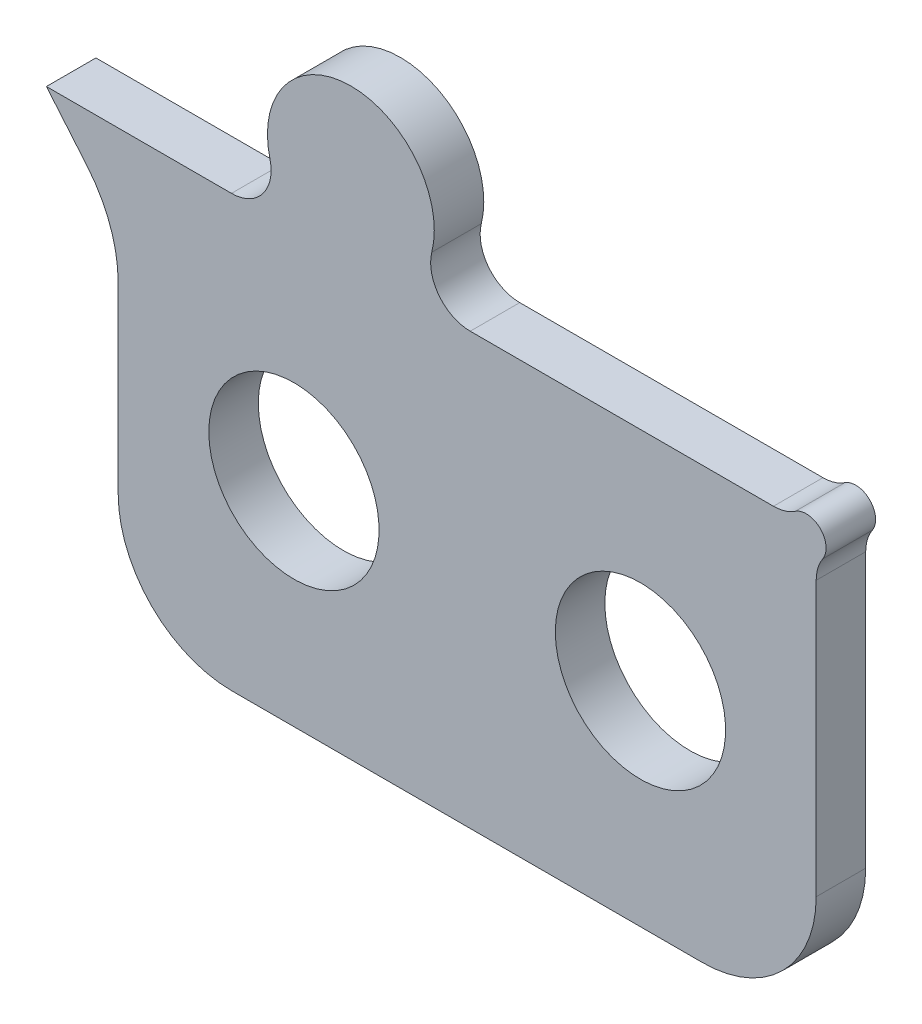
SolidWorks part; units mm, degrees
ref_plane "Front" through (0, 0, 0) normal (0, 0, 1) x (1, 0, 0)
ref_plane "Top" through (0, 0, 0) normal (0, 1, 0) x (1, 0, 0)
ref_plane "Right" through (0, 0, 0) normal (1, 0, 0) x (0, 0, -1)
sketch "Sketch1" plane through (0, 0, 0) normal (0, 0, 1) x (1, 0, 0)
  line L12 (-121.8268, -81.915) -> (-137.3848, -81.915)
  line L13 (-149.6352, -81.915) -> (-159.131, -81.915)
  line L14 (-159.131, -81.915) -> (-157.0525, -84.3921)
  line L15 (-155.448, -88.8003) -> (-155.448, -98.171)
  line L16 (-149.606, -104.013) -> (-125.476, -104.013)
  line L22 (-119.634, -98.171) -> (-119.634, -84.1078)
  line L24 (-121.8268, -81.915) -> (-137.3848, -81.915)
  line L25 (-149.6352, -81.915) -> (-159.131, -81.915)
  line L26 (-159.131, -81.915) -> (-157.0525, -84.3921)
  line L27 (-155.448, -88.8003) -> (-155.448, -98.171)
  line L28 (-149.606, -104.013) -> (-125.476, -104.013)
  line L29 (-119.634, -98.171) -> (-119.634, -84.1078)
  arc A21 (-121.8268, -81.915) -> (-120.7036, -81.5763) centre (-121.8268, -79.883) ccw
  arc A22 (-139.3567, -79.3924) -> (-137.3848, -81.915) centre (-137.3848, -79.883) ccw
  arc A23 (-139.3567, -79.3924) -> (-147.6633, -79.3924) centre (-143.51, -78.359) ccw
  arc A24 (-149.6352, -81.915) -> (-147.6633, -79.3924) centre (-149.6352, -79.883) ccw
  arc A26 (-155.448, -88.8003) -> (-157.0525, -84.3921) centre (-162.306, -88.8003) ccw
  arc A27 (-155.448, -98.171) -> (-149.606, -104.013) centre (-149.606, -98.171) ccw
  arc A28 (-125.476, -104.013) -> (-119.634, -98.171) centre (-125.476, -98.171) ccw
  arc A38 (-119.2953, -82.9846) -> (-119.634, -84.1078) centre (-117.602, -84.1078) ccw
  arc A39 (-119.2953, -82.9846) -> (-120.7036, -81.5763) centre (-120.142, -82.423) ccw
  arc A40 (-121.8268, -81.915) -> (-120.7036, -81.5763) centre (-121.8268, -79.883) ccw
  arc A41 (-139.3567, -79.3924) -> (-137.3848, -81.915) centre (-137.3848, -79.883) ccw
  arc A42 (-139.3567, -79.3924) -> (-147.6633, -79.3924) centre (-143.51, -78.359) ccw
  arc A43 (-149.6352, -81.915) -> (-147.6633, -79.3924) centre (-149.6352, -79.883) ccw
  arc A45 (-155.448, -88.8003) -> (-157.0525, -84.3921) centre (-162.306, -88.8003) ccw
  arc A46 (-155.448, -98.171) -> (-149.606, -104.013) centre (-149.606, -98.171) ccw
  arc A47 (-125.476, -104.013) -> (-119.634, -98.171) centre (-125.476, -98.171) ccw
  arc A48 (-119.2953, -82.9846) -> (-119.634, -84.1078) centre (-117.602, -84.1078) ccw
  arc A49 (-119.2953, -82.9846) -> (-120.7036, -81.5763) centre (-120.142, -82.423) ccw
  dimension "D1" = 0.508
extrude "Boss-Extrude1" add sketch "Sketch1" along normal blind 2.54 separate body
hole_wizard "Hole1" positions "Point_Sketch" profile "Profil_Sketch" hole size "Ø0.15" standard "ISO"
sketch "Point_Sketch" plane through (-143.4117, -85.0299, 0) normal (0, 0, 1) x (-1, 0, 0)
  point P0 (3.0193, 8.0611)
  point P2 (-14.7607, 8.0611)
sketch "Profil_Sketch" plane through (-146.431, -93.091, 0) normal (1, 0, 0) x (0, 1, 0)
  line L0 (0, 0) -> (0, 2.54)
  line L1 (0, 2.54) -> (4.3688, 2.54)
  line L2 (4.3688, 2.54) -> (4.3688, 0)
  line L5 (4.3688, 0) -> (0, 0)
  line L11 (0, -6.35) -> (0, 107.95) construction
  dimension "Diameter" = 8.7376
  dimension "Thru Hole Depth" = 2.54
other "usin_DL090_.3125-18x3.25-SHCS<1>"
